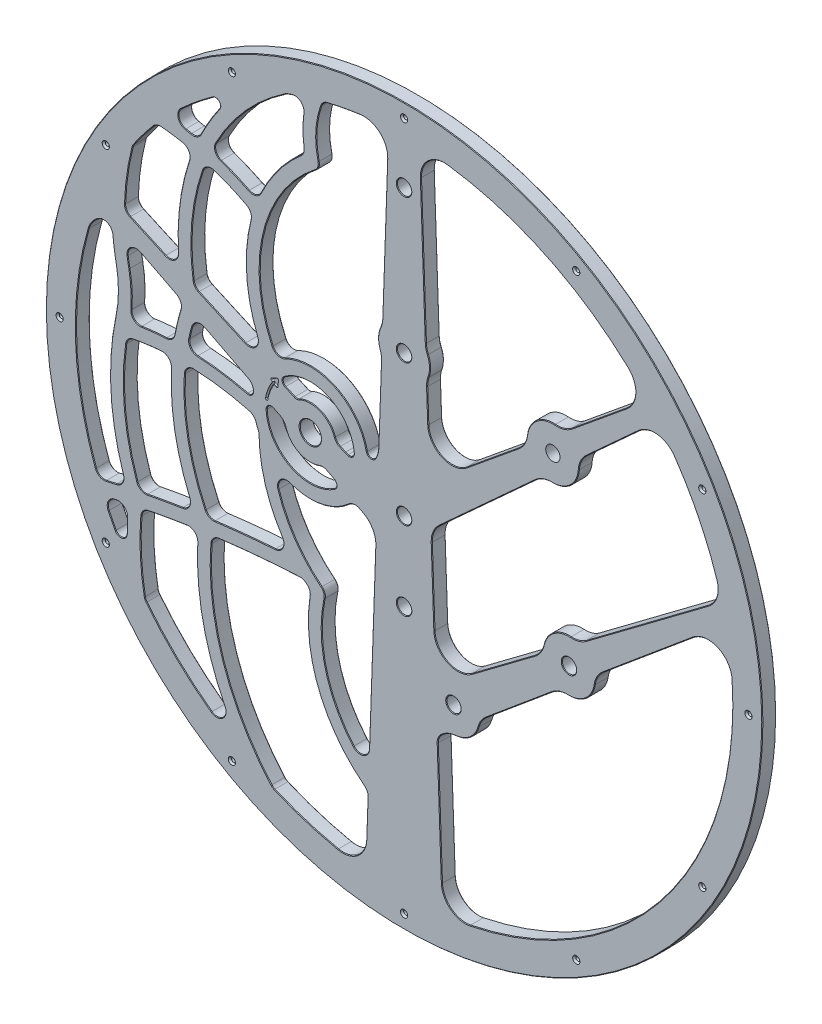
SolidWorks part; units mm, degrees
ref_plane "Спереди" through (0, 0, 0) normal (0, 0, 1) x (1, 0, 0)
ref_plane "Сверху" through (0, 0, 0) normal (0, 1, 0) x (1, 0, 0)
ref_plane "Справа" through (0, 0, 0) normal (1, 0, 0) x (0, 0, -1)
sketch "Эскиз1" plane through (0, 0, 0) normal (0, 0, 1) x (1, 0, 0)
  line L0 (0, 186.4729) -> (0, -155) construction
  line L1 (-16.3751, -129.4979) -> (-15.7977, -112.9638)
  line L2 (16.3751, -129.4979) -> (14.5719, -77.8624)
  line L3 (0, -76.9749) -> (149.4043, 41.2718) construction
  line L4 (131.591, 32.2745) -> (78.8549, -7.2633)
  line L5 (125.016, 16.8683) -> (86.0498, -15.6663)
  line L6 (131.591, 32.2745) -> (144.5236, 42.5101) construction
  line L7 (125.016, 16.8683) -> (148.2452, 35.2532) construction
  line L8 (56.5522, -23.9843) -> (29.3788, -44.357)
  line L9 (63.9818, -34.0918) -> (35.5262, -57.8507)
  line L10 (16.6684, -73.5959) -> (16.3643, -73.8498)
  line L11 (13.1304, -36.5825) -> (11.9911, -3.957)
  line L12 (7.3018, 130.3247) -> (6.2562, 160.2685) construction
  line L13 (-7.3018, 130.3247) -> (-6.2562, 160.2685) construction
  line L14 (-9.4332, 69.2905) -> (-7.3018, 130.3247)
  line L15 (9.4332, 69.2905) -> (7.3018, 130.3247)
  line L16 (0, 0) -> (117.2281, 101.403) construction
  line L17 (27.0773, 31.8104) -> (49.5494, 50.2429)
  line L18 (15.2992, 3.905) -> (56.8548, 41.7974)
  line L19 (10.4801, 39.3113) -> (9.9885, 53.3878)
  line L20 (72.6219, 69.1679) -> (96.3175, 88.604)
  line L21 (78.9053, 61.904) -> (101.5512, 82.5535)
  line L22 (96.3175, 88.604) -> (114.4037, 104.2487) construction
  line L23 (101.5512, 82.5535) -> (118.1278, 96.8925) construction
  line L24 (0, -8.6) -> (-142.8528, 60.1504) construction
  line L25 (-25.4723, 11.1102) -> (-27.7546, 12.1359)
  line L26 (-17.9626, -7.7925) -> (-19.3494, -7.0798)
  line L27 (-11.1537, 20.0228) -> (-9.9885, 53.3878)
  line L28 (-122.0022, 45.6766) -> (-146.1883, 57.3165) construction
  line L29 (-120.0439, 53.6123) -> (-142.9642, 64.6432) construction
  line L30 (0, 0) -> (74.5, 129.0378) construction
  line L31 (-47.3418, 20.9387) -> (-51.3616, 22.7453)
  line L32 (-53.4471, 10.444) -> (-56.5426, 12.0349)
  line L33 (-30.3696, -1.4162) -> (-33.465, 0.1746)
  line L34 (-67.446, 17.6385) -> (-86.2562, 27.3056)
  line L35 (-68.6353, 30.5084) -> (-88.8076, 39.5742)
  line L36 (-13.8912, -58.3698) -> (-12.4529, -17.1836)
  line L37 (-15.1654, -94.8587) -> (-13.8912, -58.3698)
  line L38 (-98.6043, 33.6517) -> (-114.0885, 41.6095)
  line L39 (-114.0885, 41.6095) -> (-122.0022, 45.6766) construction
  line L40 (0, 0) -> (-21.75, 0) construction
  line L41 (0, 0) -> (0, -515) construction
  line L42 (0, -515) -> (-21.75, -515) construction
  line L43 (-21.75, 0) -> (-21.75, -515) construction
  line L44 (0, 0) -> (-16.242, 0) construction
  line L45 (0, 0) -> (0, -10.44) construction
  line L46 (0, -10.44) -> (-16.242, -10.44) construction
  line L47 (-16.242, 0) -> (-16.242, -10.44) construction
  line L48 (0, 0) -> (-15.76, 0) construction
  line L49 (0, 0) -> (0, 53.234) construction
  line L50 (0, 53.234) -> (-15.76, 53.234) construction
  line L51 (-15.76, 0) -> (-15.76, 53.234) construction
  line L52 (-120.0439, 53.6123) -> (-118.463, 52.9019) construction
  line L53 (0, 0) -> (-96.1164, -104.5258) construction
  line L54 (-130.0207, 42.0165) -> (-122.0022, 42.0165) construction
  line L55 (-130.0207, 42.0165) -> (-130.0207, 45.6766) construction
  line L56 (-130.0207, 45.6766) -> (-122.0022, 45.6766) construction
  line L57 (-122.0022, 42.0165) -> (-122.0022, 45.6766) construction
  line L58 (-129.0378, 74.5) -> (-116.9012, 74.5) construction
  line L59 (-129.0378, 74.5) -> (-129.0378, 56.377) construction
  line L60 (-129.0378, 56.377) -> (-116.9012, 56.377) construction
  line L61 (-116.9012, 74.5) -> (-116.9012, 56.377) construction
  line L62 (-103.1694, 46.0287) -> (-118.463, 52.9019)
  line L64 (-149, 0) -> (-114.2, 0) construction
  line L65 (-149, 0) -> (-149, -5.465) construction
  line L66 (-149, -5.465) -> (-114.2, -5.465) construction
  line L67 (-114.2, 0) -> (-114.2, -5.465) construction
  arc A0 (-6.4448, 154.866) -> (0, 155) centre (0, 0) ccw
  arc A1 (135.1675, 43.5172) -> (116.7502, 80.8293) centre (0, 0) ccw
  circle A2 centre (0, 0) radius 3.1
  circle A3 centre (0, 61) radius 3.1
  circle A4 centre (0, 123.05) radius 3.1
  circle A5 centre (0, 156.05) radius 2.15 construction
  arc A6 (6.2562, 160.2685) -> (-6.2562, 160.2685) centre (0, 160.05) ccw construction
  circle A7 centre (0, 0) radius 63.75 construction
  circle A8 centre (21.37, -60.0615) radius 3.1
  circle A9 centre (71.3581, -20.4982) radius 3.1
  arc A10 (72.0949, -9.2724) -> (60.3758, -18.0585) centre (71.3581, -20.4982) ccw
  arc A11 (70.9038, -31.7391) -> (82.4995, -22.0572) centre (71.3581, -20.4982) ccw
  circle A12 centre (0, 0) radius 142 construction
  arc A13 (125.016, 16.8683) -> (141.6636, 9.7683) centre (131.5277, 9.0694) cw
  arc A14 (131.591, 32.2745) -> (135.1675, 43.5172) centre (125.4964, 40.4036) ccw
  arc A15 (22.3211, -71.2712) -> (32.23, -62.9978) centre (21.37, -60.0615) ccw
  arc A16 (13.1304, -36.5825) -> (29.3788, -44.357) centre (23.2842, -36.228) ccw
  arc A17 (22.3211, -71.2712) -> (16.6684, -73.5959) centre (23.18, -81.3949) ccw
  arc A18 (35.5262, -57.8507) -> (32.23, -62.9978) centre (42.0379, -65.6496) ccw
  arc A19 (56.5522, -23.9843) -> (60.3758, -18.0585) centre (50.4576, -15.8552) ccw
  arc A20 (63.9818, -34.0918) -> (70.9038, -31.7391) centre (70.4935, -41.8908) cw
  arc A21 (86.0498, -15.6663) -> (82.4995, -22.0572) centre (92.5615, -23.4652) ccw
  arc A22 (78.8549, -7.2633) -> (72.0949, -9.2724) centre (72.7603, 0.8658) cw
  arc A23 (14.5719, -77.8624) -> (16.3643, -73.8498) centre (19.5689, -77.6879) cw
  arc A24 (28.5733, -139.0955) -> (141.6636, 9.7683) centre (0, 0) ccw
  arc A25 (28.5733, -139.0955) -> (16.3751, -129.4979) centre (26.5289, -129.1434) cw
  arc A26 (-28.5733, -139.0955) -> (-16.3751, -129.4979) centre (-26.5289, -129.1434) ccw
  circle A27 centre (0, 0) radius 155 construction
  arc A28 (-18.8008, 140.7499) -> (-33.1506, 138.0762) centre (0, 0) ccw
  arc A29 (-10.2921, 65.5426) -> (-10.5839, 57.1864) centre (0, 61) ccw
  arc A30 (10.5839, 57.1864) -> (10.2921, 65.5426) centre (0, 61) ccw
  arc A31 (9.4332, 69.2905) -> (10.2921, 65.5426) centre (19.587, 69.645) ccw
  arc A32 (9.9885, 53.3878) -> (10.5839, 57.1864) centre (20.1424, 53.7423) cw
  arc A33 (-9.9885, 53.3878) -> (-10.5839, 57.1864) centre (-20.1424, 53.7423) ccw
  arc A34 (-9.4332, 69.2905) -> (-10.2921, 65.5426) centre (-19.587, 69.645) cw
  circle A35 centre (64.38, 55.6891) radius 3.1
  arc A36 (64.023, 44.4447) -> (75.6095, 55.0099) centre (64.38, 55.6891) ccw
  arc A37 (65.325, 66.8993) -> (53.2015, 56.9551) centre (64.38, 55.6891) ccw
  arc A38 (96.8001, 103.893) -> (18.8008, 140.7499) centre (0, 0) ccw
  arc A39 (116.7502, 80.8293) -> (101.5512, 82.5535) centre (108.3968, 75.046) ccw
  arc A40 (96.3175, 88.604) -> (96.8001, 103.893) centre (89.8741, 96.4595) ccw
  arc A41 (27.0773, 31.8104) -> (10.4801, 39.3113) centre (20.6339, 39.6659) cw
  arc A42 (15.2992, 3.905) -> (11.9911, -3.957) centre (22.1449, -3.6025) ccw
  arc A43 (49.5494, 50.2429) -> (53.2015, 56.9551) centre (43.106, 58.0984) ccw
  arc A44 (64.023, 44.4447) -> (56.8548, 41.7974) centre (63.7005, 34.2899) ccw
  arc A45 (78.9053, 61.904) -> (75.6095, 55.0099) centre (85.7509, 54.3965) ccw
  arc A46 (72.6219, 69.1679) -> (65.325, 66.8993) centre (66.1785, 77.0234) cw
  arc A47 (7.3018, 130.3247) -> (18.8008, 140.7499) centre (17.4557, 130.6793) cw
  arc A48 (-18.8008, 140.7499) -> (-7.3018, 130.3247) centre (-17.4557, 130.6793) cw
  circle A49 centre (0, 0) radius 149 construction
  arc A50 (0, 155) -> (-6.4448, 154.866) centre (0, 0) ccw
  arc A51 (-136.4071, 39.46) -> (-133.3452, -48.8166) centre (0, 0) ccw
  arc A52 (-67.7573, 12.0751) -> (-89.3834, 15.2852) centre (-96.1164, -104.5258) ccw
  arc A53 (-124.8807, 12.3334) -> (-124.731, 32.1079) centre (-173.8171, 22.5916) ccw
  arc A54 (-17.9626, -7.7925) -> (-12.4529, -17.1836) centre (-22.6068, -16.829) cw
  arc A55 (-11.1537, 20.0228) -> (-12.3895, 15.5095) centre (-21.3075, 20.3773) cw
  circle A56 centre (0, 149) radius 0.8625
  circle A57 centre (74.5, 129.0378) radius 0.8625
  circle A58 centre (129.0378, 74.5) radius 0.8625
  circle A59 centre (149, 0) radius 0.8625
  circle A60 centre (129.0378, -74.5) radius 0.8625
  circle A61 centre (74.5, -129.0378) radius 0.8625
  circle A62 centre (0, -149) radius 0.8625
  circle A63 centre (-74.5, -129.0378) radius 0.8625
  circle A64 centre (-129.0378, -74.5) radius 0.8625
  circle A65 centre (-149, 0) radius 0.8625
  circle A66 centre (-129.0378, 74.5) radius 0.8625
  circle A67 centre (-74.5, 129.0378) radius 0.8625
  circle A68 centre (0, -34) radius 3.1
  circle A69 centre (-40.57, 10.925) radius 4.6
  arc A70 (-51.4183, 7.9457) -> (-36.6774, 0.3699) centre (-40.57, 10.925) ccw
  arc A71 (-59.4552, 10.1769) -> (-30.1848, -4.8661) centre (-40.57, 10.925) ccw
  arc A72 (-65.403, 13.8101) -> (-65.414, 13.7136) centre (-40.57, 10.925) ccw
  arc A73 (-29.9064, 14.5098) -> (-45.6235, 20.9761) centre (-40.57, 10.925) ccw
  arc A74 (-21.7622, 12.7895) -> (-51.7219, 26.1843) centre (-40.57, 10.925) ccw
  arc A75 (-24.3517, 10.6841) -> (-25.4723, 11.1102) centre (-21.3075, 20.3773) cw
  arc A76 (-16.1024, 16.0572) -> (-51.7262, 33.2977) centre (-40.57, 10.925) ccw
  arc A77 (-47.3418, 20.9387) -> (-45.6235, 20.9761) centre (-46.5219, 22.763) ccw
  arc A78 (-27.7546, 12.1359) -> (-29.9064, 14.5098) centre (-26.1149, 15.7844) cw
  arc A79 (-53.4471, 10.444) -> (-51.4183, 7.9457) centre (-55.2755, 6.8864) cw
  arc A80 (-33.465, 0.1746) -> (-36.6774, 0.3699) centre (-35.2934, -3.383) ccw
  arc A81 (-51.7219, 26.1843) -> (-51.3616, 22.7453) centre (-50.5418, 24.5696) ccw
  arc A82 (-59.4552, 10.1769) -> (-56.5426, 12.0349) centre (-57.4568, 10.256) cw
  arc A83 (-30.1848, -4.8661) -> (-30.3696, -1.4162) centre (-31.2838, -3.195) ccw
  arc A84 (-21.7622, 12.7895) -> (-24.3517, 10.6841) centre (-23.7524, 12.5922) cw
  arc A85 (-12.3895, 15.5095) -> (-16.1024, 16.0572) centre (-14.145, 16.4677) cw
  arc A86 (-19.3494, -7.0798) -> (-23.8526, -7.6633) centre (-21.1778, -10.6375) ccw
  circle A87 centre (0, 0) radius 60 construction
  arc A88 (-62.9931, -0.9293) -> (-52.8193, -34.3383) centre (0, 0) ccw
  arc A89 (-54.3464, -17.1891) -> (-35.7177, -44.4212) centre (0, 0) ccw
  circle A90 centre (0, 0) radius 63 construction
  circle A91 centre (0, 0) radius 57 construction
  arc A92 (-49.3723, -12.4741) -> (-23.8526, -7.6633) centre (-40.57, 10.925) ccw
  circle A93 centre (21.37, -60.0615) radius 60 construction
  arc A94 (-40.8697, -50.3034) -> (-17.2686, -109.8215) centre (21.37, -60.0615) ccw
  arc A95 (-34.3788, -48.1843) -> (-21.8629, -97.2088) centre (21.37, -60.0615) ccw
  circle A96 centre (21.37, -60.0615) radius 63 construction
  circle A97 centre (21.37, -60.0615) radius 57 construction
  circle A98 centre (0, 61) radius 65.5 construction
  arc A99 (-44.7583, 112.8551) -> (-61.9756, 90.1767) centre (0, 61) ccw
  arc A100 (-38.337, 110.3611) -> (-56.8947, 35.1303) centre (0, 61) ccw
  circle A101 centre (0, 61) radius 68.5 construction
  circle A102 centre (0, 61) radius 62.5 construction
  circle A103 centre (0, 123.05) radius 41 construction
  arc A104 (-56.8947, 35.1303) -> (-51.7262, 33.2977) centre (-53.4264, 36.7073) ccw
  arc A105 (-43.5549, 129.2928) -> (-43.4825, 116.3219) centre (0, 123.05) ccw
  arc A106 (-35.8562, 135.6331) -> (-36.9676, 114.2523) centre (0, 123.05) ccw
  circle A107 centre (0, 123.05) radius 44 construction
  circle A108 centre (0, 123.05) radius 38 construction
  arc A109 (-48.6312, 133.4129) -> (-50.4697, 132.7283) centre (0, 0) ccw
  circle A110 centre (21.37, -60.0615) radius 108 construction
  arc A111 (-89.4917, -54.523) -> (-77.6629, -110.1961) centre (21.37, -60.0615) ccw
  arc A112 (-83.329, -52.1162) -> (-57.3991, -129.4908) centre (21.37, -60.0615) ccw
  circle A113 centre (21.37, -60.0615) radius 111 construction
  circle A114 centre (21.37, -60.0615) radius 105 construction
  arc A115 (-56.0447, -130.4722) -> (-28.5733, -139.0955) centre (0, 0) ccw
  circle A116 centre (0, 0) radius 98 construction
  arc A117 (-96.6981, 29.1629) -> (-99.3106, 18.3956) centre (0, 0) ccw
  arc A118 (-91.6743, 24.9162) -> (-92.8952, 19.8867) centre (0, 0) ccw
  circle A119 centre (0, 0) radius 95 construction
  circle A120 centre (0, 0) radius 101 construction
  circle A121 centre (-21.75, -515) radius 473 construction
  arc A122 (-55.7416, -40.2152) -> (-81.9288, -42.8194) centre (-21.75, -515) ccw
  arc A123 (-45.1814, -45.5844) -> (-80.0021, -48.6239) centre (-21.75, -515) ccw
  circle A124 centre (-21.75, -515) radius 476 construction
  circle A125 centre (-21.75, -515) radius 470 construction
  arc A126 (-42.4257, -46.5731) -> (-42.0884, -46.8782) centre (0, 0) ccw
  arc A127 (-93.8817, -50.5681) -> (-110.5586, -53.4667) centre (-21.75, -515) ccw
  arc A128 (-95.8482, -44.8027) -> (-111.0888, -47.459) centre (-21.75, -515) ccw
  arc A129 (-127.7958, -61.9051) -> (-124.7704, -67.7963) centre (0, 0) ccw
  circle A130 centre (0, -66) radius 117 construction
  arc A131 (-119.8631, -60.2691) -> (-119.9986, -66.5715) centre (0, -66) ccw
  arc A132 (-113.6365, -56.904) -> (-112.1658, -86.3674) centre (0, -66) ccw
  circle A133 centre (0, -66) radius 114 construction
  circle A134 centre (0, -66) radius 120 construction
  arc A135 (-124.5017, -56.3693) -> (-125.2055, -56.5276) centre (-21.75, -515) ccw
  arc A136 (-111.4063, -88.0491) -> (-83.2971, -115.0026) centre (0, 0) ccw
  arc A137 (-119.8631, -60.2691) -> (-124.5017, -56.3693) centre (-123.6687, -60.0872) ccw
  arc A138 (-127.7958, -61.9051) -> (-125.2055, -56.5276) centre (-124.3669, -60.2441) cw
  arc A139 (-43.5549, 129.2928) -> (-48.6312, 133.4129) centre (-47.3263, 129.8333) ccw
  arc A140 (-35.8562, 135.6331) -> (-33.1506, 138.0762) centre (-32.2611, 134.3715) cw
  arc A141 (-43.4825, 116.3219) -> (-44.7583, 112.8551) centre (-47.2477, 115.7393) cw
  arc A142 (-36.9676, 114.2523) -> (-38.337, 110.3611) centre (-40.674, 113.3702) cw
  arc A143 (-62.9931, -0.9293) -> (-63.3336, 0.5896) centre (-66.8027, -0.9855) ccw
  arc A144 (-55.7416, -40.2152) -> (-52.8193, -34.3383) centre (-56.0136, -36.415) ccw
  arc A145 (-85.8537, -40.6711) -> (-81.9288, -42.8194) centre (-82.4105, -39.04) ccw
  arc A146 (-113.6365, -56.904) -> (-110.5586, -53.4667) centre (-109.8387, -57.208) cw
  arc A147 (-112.1658, -86.3674) -> (-111.4063, -88.0491) centre (-108.4171, -85.6867) ccw
  arc A148 (-89.4917, -54.523) -> (-93.8817, -50.5681) centre (-93.297, -54.3329) ccw
  arc A149 (-77.6629, -110.1961) -> (-83.2971, -115.0026) centre (-81.0622, -111.9169) cw
  arc A150 (-57.3991, -129.4908) -> (-56.0447, -130.4722) centre (-54.5409, -126.9715) ccw
  arc A151 (-17.2686, -109.8215) -> (-15.7977, -112.9638) centre (-19.6053, -112.8308) cw
  arc A152 (-45.1814, -45.5844) -> (-42.4257, -46.5731) centre (-44.9915, -49.3897) cw
  arc A153 (-42.0884, -46.8782) -> (-40.8697, -50.3034) centre (-44.6337, -49.7133) cw
  arc A154 (-54.3464, -17.1891) -> (-49.3723, -12.4741) centre (-50.7138, -16.0401) cw
  arc A155 (-34.3788, -48.1843) -> (-35.7177, -44.4212) centre (-38.1052, -47.3904) ccw
  arc A156 (-21.8629, -97.2088) -> (-15.1654, -94.8587) centre (-18.9731, -94.7258) ccw
  arc A157 (-83.329, -52.1162) -> (-80.0021, -48.6239) centre (-79.5299, -52.4045) cw
  arc A158 (-119.9986, -66.5715) -> (-124.7704, -67.7963) centre (-122.5386, -66.5836) cw
  circle A159 centre (-16.242, -10.44) radius 108 construction
  arc A160 (-124.8807, 12.3334) -> (-121.6296, -45.2891) centre (-16.242, -10.44) ccw
  arc A161 (-120.2007, 4.3112) -> (-115.402, -44.9697) centre (-16.242, -10.44) ccw
  circle A162 centre (-16.242, -10.44) radius 105 construction
  circle A163 centre (-16.242, -10.44) radius 111 construction
  arc A164 (-124.4251, -50.2056) -> (-128.9097, -51.219) centre (-21.75, -515) ccw
  circle A165 centre (-15.76, 53.234) radius 108 construction
  arc A166 (-126.2289, 42.3888) -> (-124.731, 32.1079) centre (-15.76, 53.234) ccw
  arc A167 (-117.4443, 79.4125) -> (-120.7093, 56.4954) centre (-15.76, 53.234) ccw
  circle A168 centre (-15.76, 53.234) radius 111 construction
  circle A169 centre (-15.76, 53.234) radius 105 construction
  arc A170 (-119.5979, 37.6555) -> (-118.8407, 33.2499) centre (-15.76, 53.234) ccw
  arc A171 (-132.0447, 45.2445) -> (-136.4071, 39.46) centre (-126.6473, 36.6367) ccw
  arc A172 (-117.9854, 18.2535) -> (-118.8407, 33.2499) centre (-173.8171, 22.5916) ccw
  circle A173 centre (-173.8171, 22.5916) radius 50 construction
  circle A174 centre (-173.8171, 22.5916) radius 56 construction
  arc A175 (-117.4443, 79.4125) -> (-116.8909, 80.6258) centre (-113.7546, 78.4626) cw
  arc A176 (-126.2289, 42.3888) -> (-132.0447, 45.2445) centre (-130.0207, 42.0165) ccw
  arc A177 (-119.5979, 37.6555) -> (-114.0885, 41.6095) centre (-115.8301, 38.2208) cw
  arc A178 (-96.6981, 29.1629) -> (-98.6043, 33.6517) centre (-100.3458, 30.263) ccw
  arc A179 (-67.446, 17.6385) -> (-65.403, 13.8101) centre (-69.1875, 14.2498) cw
  arc A180 (-91.6743, 24.9162) -> (-86.2562, 27.3056) centre (-87.9977, 23.9169) cw
  arc A181 (-92.9355, -39.5474) -> (-95.8482, -44.8027) centre (-96.4413, -41.0392) cw
  arc A182 (-115.402, -44.9697) -> (-111.0888, -47.459) centre (-111.8039, -43.7167) ccw
  arc A183 (-133.3452, -48.8166) -> (-128.9097, -51.219) centre (-129.7674, -47.5068) ccw
  arc A184 (-121.6296, -45.2891) -> (-124.4251, -50.2056) centre (-125.2469, -46.4853) cw
  arc A185 (-120.7093, 56.4954) -> (-118.463, 52.9019) centre (-116.9012, 56.377) ccw
  arc A186 (-66.9918, 5.6911) -> (-90.845, 9.3523) centre (-96.1164, -104.5258) ccw
  circle A187 centre (-96.1164, -104.5258) radius 114 construction
  circle A188 centre (-96.1164, -104.5258) radius 120 construction
  arc A189 (-100.8692, 5.1376) -> (-92.9355, -39.5474) centre (0, 0) ccw
  arc A190 (-102.8433, 15.2855) -> (-113.6307, 14.1892) centre (-96.1164, -104.5258) ccw
  arc A191 (-104.9702, 9.1299) -> (-117.1308, 7.5206) centre (-96.1164, -104.5258) ccw
  arc A192 (-94.8241, 5.7781) -> (-85.8537, -40.6711) centre (0, 0) ccw
  arc A193 (-64.3423, 3.1868) -> (-63.3336, 0.5896) centre (-40.57, 10.925) ccw
  arc A194 (-66.9918, 5.6911) -> (-64.3423, 3.1868) centre (-67.9651, 2.0075) cw
  arc A195 (-89.3834, 15.2852) -> (-92.8952, 19.8867) centre (-89.1696, 19.0892) cw
  arc A196 (-90.845, 9.3523) -> (-94.8241, 5.7781) centre (-91.0212, 5.5463) ccw
  arc A197 (-100.8692, 5.1376) -> (-104.9702, 9.1299) centre (-104.6743, 5.3314) ccw
  arc A198 (-99.3106, 18.3956) -> (-102.8433, 15.2855) centre (-103.0569, 19.0895) cw
  arc A199 (-67.7573, 12.0751) -> (-65.414, 13.7136) centre (-67.3071, 13.9261) ccw
  arc A200 (-113.6307, 14.1892) -> (-117.9854, 18.2535) centre (-114.1868, 17.9584) cw
  arc A201 (-117.1308, 7.5206) -> (-120.2007, 4.3112) centre (-116.4284, 3.7759) ccw
  circle A202 centre (0, 55.92) radius 95 construction
  arc A203 (-79.9182, 112.6394) -> (-87.9103, 99.2302) centre (0, 55.92) ccw
  arc A204 (-51.2375, 132.3315) -> (-81.335, 98.9156) centre (0, 55.92) ccw
  circle A205 centre (0, 55.92) radius 98 construction
  circle A206 centre (0, 55.92) radius 92 construction
  arc A207 (-82.7141, 115.4226) -> (-96.4448, 104.2229) centre (0, 0) ccw
  arc A208 (-51.2375, 132.3315) -> (-50.4697, 132.7283) centre (-49.1156, 129.1671) cw
  arc A209 (-91.015, 42.4933) -> (-88.8076, 39.5742) centre (-87.2458, 43.0494) ccw
  arc A210 (-97.8052, 49.744) -> (-103.1694, 46.0287) centre (-101.6076, 49.5038) cw
  arc A211 (-67.1306, 88.3938) -> (-79.2354, 93.5424) centre (-114.2, -5.465) ccw
  arc A212 (-68.2992, 82.2511) -> (-82.1623, 88.2078) centre (-114.2, -5.465) ccw
  circle A213 centre (-114.2, -5.465) radius 99 construction
  circle A214 centre (-114.2, -5.465) radius 105 construction
  arc A215 (-108.3499, 91.784) -> (-116.8909, 80.6258) centre (0, 0) ccw
  arc A216 (-66.374, 77.9335) -> (-63.5394, 35.4071) centre (0, 61) ccw
  arc A217 (-95.8915, 91.8273) -> (-105.0923, 93.1152) centre (-114.2, -5.465) ccw
  arc A218 (-92.1289, 97.1891) -> (-94.5694, 97.6836) centre (-114.2, -5.465) ccw
  arc A219 (-86.9981, 85.8419) -> (-91.015, 42.4933) centre (0, 55.92) ccw
  arc A220 (-92.9813, 86.8794) -> (-97.8052, 49.744) centre (0, 55.92) ccw
  arc A221 (-94.5694, 97.6836) -> (-96.4448, 104.2229) centre (-93.8571, 101.4264) cw
  arc A222 (-92.1289, 97.1891) -> (-87.9103, 99.2302) centre (-91.3281, 100.914) ccw
  arc A223 (-79.2354, 93.5424) -> (-81.335, 98.9156) centre (-77.9667, 97.135) cw
  arc A224 (-67.1306, 88.3938) -> (-61.9756, 90.1767) centre (-65.4227, 91.7995) ccw
  arc A225 (-68.2992, 82.2511) -> (-66.374, 77.9335) centre (-70.0657, 78.8754) cw
  arc A226 (-82.1623, 88.2078) -> (-86.9981, 85.8419) centre (-83.3953, 84.6028) ccw
  arc A227 (-95.8915, 91.8273) -> (-92.9813, 86.8794) centre (-96.5961, 88.0831) cw
  arc A228 (-105.0923, 93.1152) -> (-108.3499, 91.784) centre (-105.4428, 89.3213) ccw
  arc A229 (-79.9182, 112.6394) -> (-82.7141, 115.4226) centre (-81.5491, 113.7969) ccw
  arc A230 (-68.6353, 30.5084) -> (-63.5394, 35.4071) centre (-67.0735, 33.9836) ccw
  point P47 (19.5766, -71.1677)
  point P53 (67.5738, -31.0927)
  point P76 (9.9087, 55.6728)
  point P96 (104.9334, 95.6712)
  point P101 (11.1969, 18.7847)
  point P112 (68.8011, 66.034)
  point P119 (6.4448, 154.866)
  point P122 (-6.4448, 154.866)
  point P133 (-132.4982, 51.0708)
  point P181 (-29.4982, 12.9195)
  point P192 (-27.6119, -2.8335)
  point P195 (-21.683, 10.2243)
  point P198 (-15.5922, 11.9773)
  point P276 (-119.5204, -55.2817)
  point P279 (-129.7983, -57.5882)
  point P282 (-42.1745, 135.5925)
  point P299 (-111.9919, -87.303)
  point P302 (-89.1602, -49.8593)
  point P307 (-56.8287, -130.1326)
  point P312 (-43.5677, -45.5067)
  point P317 (-56.3703, -8.4489)
  point P322 (-15.4692, -103.5572)
  point P364 (-95.737, 32.1781)
  point P371 (-90.8888, -44.048)
  point P378 (-120.2188, -49.2964)
  point P397 (-64.885, 5.1127)
  point P402 (-94.5275, 9.4631)
  point P405 (-100.5628, 9.3875)
  point P408 (-99.8164, 15.4172)
  point P431 (-97.1894, 43.3411)
  point P456 (-65.5834, 80.7755)
  point P459 (-85.7122, 89.3477)
  point P462 (-91.5418, 90.9072)
  point P465 (-107.0667, 93.2777)
  point P468 (-72.0208, 122.3806)
  dimension "D1" = 310
  dimension "D2" = 13
  dimension "D3" = 6.2
  dimension "D6" = 4.3
  dimension "D8" = 12.52
  dimension "D12" = 127.5
  dimension "D15" = 22.5
  dimension "D17" = 10.16
  dimension "D22" = 10.16
  dimension "D23" = 10.16
  dimension "D24" = 5
  dimension "D26" = 10.16
  dimension "D28" = 10.16
  dimension "D32" = 10.16
  dimension "D36" = 10.16
  dimension "D37" = 10.16
  dimension "D38" = 10.16
  dimension "D39" = 298
  dimension "D44" = 3.66
  dimension "D47" = 10.16
  dimension "D48" = 1.725
  dimension "D52" = 9.2
  dimension "D54" = 37.8
  dimension "D55" = 50
  dimension "D56" = 2
  dimension "D57" = 4
  dimension "D58" = 4
  dimension "D59" = 2
  dimension "D60" = 2
  dimension "D61" = 4
  dimension "D62" = 120
  dimension "D67" = 131
  dimension "D70" = 82
  dimension "D73" = 216
  dimension "D76" = 196
  dimension "D81" = 946
  dimension "D84" = 234
  dimension "D88" = 3.81
  dimension "D89" = 2.54
  dimension "D92" = 216
  dimension "D97" = 216
  dimension "D100" = 10.16
  dimension "D101" = 100
  dimension "D103" = 3.81
  dimension "D104" = 7.62
  dimension "D107" = 240
  dimension "D109" = 3.81
  dimension "D110" = 1.905
  dimension "D111" = 3.81
  dimension "D112" = 190
  dimension "D116" = 3.81
  dimension "D119" = 210
  dimension "D121" = 3.81
  dimension "D122" = 2
  dimension "D123" = 7.62
  dimension "D124" = 3.81
  dimension "D4" = 61
  dimension "D5" = 62.05
  dimension "D7" = 156.05
  dimension "D9" = 4
  dimension "D10" = 4
  dimension "D11" = 51.64
  dimension "D13" = 21.37
  dimension "D14" = 63.75
  dimension "D16" = 3
  dimension "D18" = 8
  dimension "D19" = 4
  dimension "D20" = 1.5
  dimension "D21" = 2
  dimension "D25" = 2
  dimension "D27" = 32.7501
  dimension "D29" = 64.38
  dimension "D30" = 49.14
  dimension "D31" = 3
  dimension "D33" = 1.5
  dimension "D34" = 8
  dimension "D35" = 4
  dimension "D40" = 64.3
  dimension "D41" = 8.6
  dimension "D42" = 1.5
  dimension "D43" = 3
  dimension "D45" = 4
  dimension "D46" = 8
  dimension "D50" = 30
  dimension "D51" = 34
  dimension "D53" = 40.57
  dimension "D79" = 21.75
  dimension "D80" = 515
  dimension "D85" = 32
  dimension "D90" = 16.242
  dimension "D91" = 10.44
  dimension "D95" = 15.76
  dimension "D96" = 53.234
  dimension "D102" = 6
  dimension "D105" = 18.123
  dimension "D106" = 42.6
  dimension "D113" = 5.08
  dimension "D117" = 34.8
  dimension "D118" = 5.465
  dimension "D63" = 3
  dimension "D64" = 3
  dimension "D65" = 3
  dimension "D66" = 3
  dimension "D68" = 3
  dimension "D69" = 3
  dimension "D71" = 3
  dimension "D72" = 3
  dimension "D74" = 3
  dimension "D75" = 3
  dimension "D77" = 3
  dimension "D78" = 3
  dimension "D82" = 3
  dimension "D83" = 3
  dimension "D86" = 3
  dimension "D87" = 3
  dimension "D93" = 3
  dimension "D94" = 3
  dimension "D98" = 3
  dimension "D99" = 3
  dimension "D108" = 6
  dimension "D114" = 3
  dimension "D115" = 3
  dimension "D120" = 6
  dimension "D49" = 12
extrude "Бобышка-Вытянуть1" add sketch "Эскиз1" along normal blind 6
chamfer "Фаска1" distance 0.7 angle 45 12 edges at (-73.6375, 129.0378, 6) (-128.1753, 74.5, 6) (-148.1375, 0, 6) (-128.1753, -74.5, 6) (-73.6375, -129.0378, 6) (0.8625, -149, 6) (75.3625, -129.0378, 6) (129.9003, -74.5, 6) (149.8625, 0, 6) (129.9003, 74.5, 6) (75.3625, 129.0378, 6) (0.8625, 149, 6)
chamfer "Фаска2" distance 0.25 angle 45 211 edges at (-89.7543, 110.0371, 0) (-80.1382, 115.2144, 0) (-84.1817, 106.0942, 0) (-89.6687, 97.4843, 0) (-93.3477, 97.4436, 0) (-97.5194, 100.3761, 0) (-65.4085, 13.7619, 0) (-66.2154, 12.3649, 0) (-78.4971, 14.1737, 0) (-92.1983, 16.7777, 0) (-92.319, 22.4098, 0) (-89.5351, 27.403, 0) (-76.8511, 22.472, 0) (-65.8262, 16.0436, 0) (-112.7585, 86.3106, 0) (-106.884, 92.8482, 0) (-100.4768, 92.5792, 0) (-93.3121, 90.0147, 0) (-97.1835, 68.5443, 0) (-99.4383, 46.3717, 0) (-110.8162, 49.4653, 0) (-120.1319, 54.3575, 0) (-119.7103, 68.0442, 0) (-117.2211, 80.0436, 0) (-60.2675, -18.3529, 0) (-52.6021, -38.1113, 0) (-68.8532, -41.3363, 0) (-84.2399, -42.3821, 0) (-93.2765, -18.0138, 0) (-93.5672, 8.3808, 0) (-78.8212, 8.1546, 0) (-65.348, 4.7764, 0) (-63.8741, 1.8742, 0) (-63.085, -0.1522, 0) (-119.9722, -63.4194, 0) (-121.9071, -69.0439, 0) (-126.3174, -64.8684, 0) (-127.7994, -58.5908, 0) (-124.8536, -56.4483, 0) (-121.2169, -57.1709, 0) (-54.9948, 11.2395, 0) (-52.1704, 9.4079, 0) (-45.7124, 0.9191, 0) (-35.0507, 0.6096, 0) (-31.9173, -0.6208, 0) (-29.2866, -3.0881, 0) (-49.2092, -5.8849, 0) (-58.5324, 11.9422, 0) (-73.6375, 129.0378, 0) (-148.1375, 0, 0) (-73.6375, -129.0378, 0) (75.3625, -129.0378, 0) (149.8625, 0, 0) (75.3625, 129.0378, 0) (-26.6135, 11.6231, 0) (-29.0786, 13.098, 0) (-36.2896, 21.3289, 0) (-46.4784, 20.7634, 0) (-49.3517, 21.842, 0) (-52.5309, 24.3612, 0) (-32.8558, 28.1791, 0) (-22.4907, 11.0404, 0) (-24.9183, 10.8806, 0) (-128.3414, 45.4365, 0) (-125.6003, 37.2308, 0) (-123.8185, 22.2132, 0) (-127.0657, -16.6929, 0) (-121.9349, -48.3685, 0) (-126.6686, -50.7069, 0) (-131.5819, -50.857, 0) (-141.9147, -4.9224, 0) (-134.759, 42.7543, 0) (67.48, 55.6891, 0) (8.3675, 99.8076, 0) (10.6315, 138.2064, 0) (60.6671, 128.3881, 0) (100.029, 96.1389, 0) (84.4697, 78.886, 0) (69.1949, 67.3215, 0) (57.2454, 64.3873, 0) (52.0305, 53.2426, 0) (38.3133, 41.0267, 0) (16.4497, 30.4075, 0) (10.2343, 46.3495, 0) (10.1049, 55.3155, 0) (11.2431, 61.3926, 0) (9.6837, 67.3755, 0) (12.5607, -20.2698, 0) (12.7801, 0.338, 0) (36.077, 22.8512, 0) (60.1805, 43.8206, 0) (71.9601, 47.3762, 0) (76.5845, 58.7786, 0) (90.2282, 72.2287, 0) (109.5421, 85.1413, 0) (127.333, 62.8515, 0) (135.1783, 37.3236, 0) (105.2229, 12.5056, 0) (75.6548, -8.8732, 0) (64.6096, -11.4971, 0) (58.9946, -21.3638, 0) (42.9655, -34.1706, 0) (18.899, -45.3929, 0) (24.47, -60.0615, 0) (3.1, 61, 0) (113.0719, -85.8996, 0) (20.2464, -137.1281, 0) (15.4735, -103.6801, 0) (15.0036, -75.6486, 0) (16.5163, -73.7229, 0) (19.3158, -71.9984, 0) (28.5803, -68.6972, 0) (33.4819, -60.1705, 0) (49.754, -45.9712, 0) (67.2238, -32.2713, 0) (78.5684, -29.1339, 0) (83.6799, -18.5313, 0) (105.5329, 0.601, 0) (135.5135, 18.4149, 0) (155, 0, 0) (3.1, 0, 0) (3.1, 123.05, 0) (74.4581, -20.4982, 0) (-56.7764, -130.0567, 0) (-78.1882, -93.4255, 0) (-82.2885, -49.7766, 0) (-62.62, -46.7803, 0) (-43.7048, -45.8035, 0) (-42.2573, -46.726, 0) (-41.0442, -48.4361, 0) (-37.1937, -83.2841, 0) (-16.1547, -111.2155, 0) (-16.0864, -121.2308, 0) (-20.2464, -137.1281, 0) (-42.5281, -135.482, 0) (-10.5711, 36.7053, 0) (-11.5082, 17.694, 0) (-14.4369, 14.4891, 0) (-29.6793, 33.4282, 0) (-60.6811, 75.9686, 0) (-37.0801, 112.1054, 0) (-37.9488, 125.0226, 0) (-34.8145, 137.1992, 0) (-26.0101, 139.5975, 0) (-10.6315, 138.2064, 0) (-8.3675, 99.8076, 0) (-9.6837, 67.3755, 0) (-11.2431, 61.3926, 0) (-10.1049, 55.3155, 0) (0.8625, 149, 0) (-13.8092, -56.0211, 0) (-17.7116, -98.3209, 0) (-33.8586, -74.1614, 0) (-34.5156, -46.1132, 0) (-47.0456, -32.1825, 0) (-53.3349, -13.275, 0) (-35.9388, -13.6423, 0) (-21.6918, -6.6706, 0) (-18.656, -7.4362, 0) (-13.8436, -11.6877, 0) (3.1, -34, 0) (129.9003, 74.5, 0) (129.9003, -74.5, 0) (0.8625, -149, 0) (-128.1753, -74.5, 0) (-128.1753, 74.5, 0) (-35.97, 10.925, 0) (-78.7214, 35.0413, 0) (-90.2847, 40.7514, 0) (-91.6075, 64.4087, 0) (-85.0696, 88.0252, 0) (-75.1171, 85.4939, 0) (-66.586, 80.427, 0) (-68.3483, 56.4442, 0) (-64.4331, 31.2369, 0) (-43.9993, 122.8046, 0) (-43.6721, 114.4235, 0) (-54.5583, 102.4204, 0) (-64.1773, 88.1988, 0) (-73.1023, 91.1579, 0) (-81.5153, 95.7483, 0) (-68.3595, 117.4909, 0) (-50.8649, 132.5518, 0) (-49.5516, 133.0738, 0) (-44.9253, 132.7916, 0) (-102.2332, -51.9423, 0) (-90.7468, -51.5023, 0) (-87.2063, -83.1306, 0) (-78.5894, -114.8155, 0) (-98.2801, -102.494, 0) (-111.8894, -87.2549, 0) (-113.8582, -71.6835, 0) (-112.6771, -54.6664, 0) (-119.2428, 35.4487, 0) (-118.0515, 41.3162, 0) (-106.3464, 37.6306, 0) (-96.8389, 31.7522, 0) (-98.1521, 23.8151, 0) (-100.5393, 16.2298, 0) (-108.2494, 14.8593, 0) (-116.7865, 15.1731, 0) (-117.908, 25.7805, 0) (-93.1089, -42.8861, 0) (-103.4793, -46.069, 0) (-113.7084, -47.0166, 0) (-120.7477, -20.6161, 0) (-119.1817, 6.4095, 0) (-111.0722, 8.4889, 0) (-102.0167, 8.0614, 0) (-99.4447, -17.6563, 0) (-54.6997, 33.1164, 0)
chamfer "Фаска3" distance 0.25 angle 45 198 edges at (155, 0, 6) (-84.1817, 106.0942, 6) (-80.1382, 115.2144, 6) (-89.6687, 97.4843, 6) (-89.7543, 110.0371, 6) (-93.3477, 97.4436, 6) (-97.5194, 100.3761, 6) (-44.9253, 132.7916, 6) (-49.5516, 133.0738, 6) (-43.9993, 122.8046, 6) (-50.8649, 132.5518, 6) (-43.6721, 114.4235, 6) (-68.3595, 117.4909, 6) (-54.5583, 102.4204, 6) (-81.5153, 95.7483, 6) (-64.1773, 88.1988, 6) (-73.1023, 91.1579, 6) (-68.3483, 56.4442, 6) (-66.586, 80.427, 6) (-75.1171, 85.4939, 6) (-85.0696, 88.0252, 6) (-91.6075, 64.4087, 6) (-90.2847, 40.7514, 6) (-78.7214, 35.0413, 6) (-106.884, 92.8482, 6) (-112.7585, 86.3106, 6) (-100.4768, 92.5792, 6) (-117.2211, 80.0436, 6) (-93.3121, 90.0147, 6) (-119.7103, 68.0442, 6) (-97.1835, 68.5443, 6) (-120.1319, 54.3575, 6) (-99.4383, 46.3717, 6) (-110.8162, 49.4653, 6) (-76.8511, 22.472, 6) (-89.5351, 27.403, 6) (-65.8262, 16.0436, 6) (-92.319, 22.4098, 6) (-65.4085, 13.7619, 6) (-92.1983, 16.7777, 6) (-66.2154, 12.3649, 6) (-78.4971, 14.1737, 6) (-118.0515, 41.3162, 6) (-106.3464, 37.6306, 6) (-119.2428, 35.4487, 6) (-96.8389, 31.7522, 6) (-117.908, 25.7805, 6) (-98.1521, 23.8151, 6) (-116.7865, 15.1731, 6) (-100.5393, 16.2298, 6) (-108.2494, 14.8593, 6) (-125.6003, 37.2308, 6) (-123.8185, 22.2132, 6) (-128.3414, 45.4365, 6) (-127.0657, -16.6929, 6) (-134.759, 42.7543, 6) (-121.9349, -48.3685, 6) (-141.9147, -4.9224, 6) (-126.6686, -50.7069, 6) (-131.5819, -50.857, 6) (-111.0722, 8.4889, 6) (-119.1817, 6.4095, 6) (-102.0167, 8.0614, 6) (-120.7477, -20.6161, 6) (-99.4447, -17.6563, 6) (-113.7084, -47.0166, 6) (-93.1089, -42.8861, 6) (-103.4793, -46.069, 6) (-124.8536, -56.4483, 6) (-127.7994, -58.5908, 6) (-121.2169, -57.1709, 6) (-126.3174, -64.8684, 6) (-119.9722, -63.4194, 6) (-121.9071, -69.0439, 6) (-102.2332, -51.9423, 6) (-112.6771, -54.6664, 6) (-90.7468, -51.5023, 6) (-113.8582, -71.6835, 6) (-87.2063, -83.1306, 6) (-111.8894, -87.2549, 6) (-78.5894, -114.8155, 6) (-98.2801, -102.494, 6) (-16.0864, -121.2308, 6) (-16.1547, -111.2155, 6) (-20.2464, -137.1281, 6) (-37.1937, -83.2841, 6) (-42.5281, -135.482, 6) (-41.0442, -48.4361, 6) (-56.7764, -130.0567, 6) (-42.2573, -46.726, 6) (-78.1882, -93.4255, 6) (-43.7048, -45.8035, 6) (-82.2885, -49.7766, 6) (-62.62, -46.7803, 6) (-65.348, 4.7764, 6) (-78.8212, 8.1546, 6) (-63.8741, 1.8742, 6) (-93.5672, 8.3808, 6) (-63.085, -0.1522, 6) (-93.2765, -18.0138, 6) (-60.2675, -18.3529, 6) (-84.2399, -42.3821, 6) (-52.6021, -38.1113, 6) (-68.8532, -41.3363, 6) (-13.8436, -11.6877, 6) (-18.656, -7.4362, 6) (-13.8092, -56.0211, 6) (-21.6918, -6.6706, 6) (-17.7116, -98.3209, 6) (-35.9388, -13.6423, 6) (-33.8586, -74.1614, 6) (-53.3349, -13.275, 6) (-34.5156, -46.1132, 6) (-47.0456, -32.1825, 6) (-45.7124, 0.9191, 6) (-52.1704, 9.4079, 6) (-35.0507, 0.6096, 6) (-54.9948, 11.2395, 6) (-31.9173, -0.6208, 6) (-58.5324, 11.9422, 6) (-29.2866, -3.0881, 6) (-49.2092, -5.8849, 6) (-35.97, 10.925, 6) (-49.3517, 21.842, 6) (-52.5309, 24.3612, 6) (-46.4784, 20.7634, 6) (-32.8558, 28.1791, 6) (-36.2896, 21.3289, 6) (-22.4907, 11.0404, 6) (-29.0786, 13.098, 6) (-24.9183, 10.8806, 6) (-26.6135, 11.6231, 6) (-29.6793, 33.4282, 6) (-14.4369, 14.4891, 6) (-11.5082, 17.694, 6) (-10.5711, 36.7053, 6) (-10.1049, 55.3155, 6) (-11.2431, 61.3926, 6) (-9.6837, 67.3755, 6) (-8.3675, 99.8076, 6) (-10.6315, 138.2064, 6) (-26.0101, 139.5975, 6) (-34.8145, 137.1992, 6) (-37.9488, 125.0226, 6) (-37.0801, 112.1054, 6) (-60.6811, 75.9686, 6) (3.1, 123.05, 6) (3.1, 61, 6) (60.6671, 128.3881, 6) (10.6315, 138.2064, 6) (100.029, 96.1389, 6) (8.3675, 99.8076, 6) (84.4697, 78.886, 6) (9.6837, 67.3755, 6) (69.1949, 67.3215, 6) (11.2431, 61.3926, 6) (57.2454, 64.3873, 6) (10.1049, 55.3155, 6) (52.0305, 53.2426, 6) (10.2343, 46.3495, 6) (38.3133, 41.0267, 6) (16.4497, 30.4075, 6) (3.1, 0, 6) (3.1, -34, 6) (109.5421, 85.1413, 6) (90.2282, 72.2287, 6) (127.333, 62.8515, 6) (76.5845, 58.7786, 6) (135.1783, 37.3236, 6) (71.9601, 47.3762, 6) (105.2229, 12.5056, 6) (60.1805, 43.8206, 6) (75.6548, -8.8732, 6) (36.077, 22.8512, 6) (64.6096, -11.4971, 6) (12.7801, 0.338, 6) (58.9946, -21.3638, 6) (12.5607, -20.2698, 6) (42.9655, -34.1706, 6) (18.899, -45.3929, 6) (74.4581, -20.4982, 6) (24.47, -60.0615, 6) (67.2238, -32.2713, 6) (49.754, -45.9712, 6) (78.5684, -29.1339, 6) (33.4819, -60.1705, 6) (83.6799, -18.5313, 6) (28.5803, -68.6972, 6) (105.5329, 0.601, 6) (19.3158, -71.9984, 6) (135.5135, 18.4149, 6) (16.5163, -73.7229, 6) (113.0719, -85.8996, 6) (15.0036, -75.6486, 6) (20.2464, -137.1281, 6) (15.4735, -103.6801, 6) (-64.4331, 31.2369, 6) (-54.6997, 33.1164, 6)
sketch "Эскиз3" plane through (0, 0, 6) normal (0, 0, 1) x (1, 0, 0)
  line L0 (-40.57, 10.925) -> (-58.2514, 19.4976) construction
  line L1 (-49.4542, 21.614) -> (-52.3676, 16.6449) construction
  line L2 (-47.4443, 20.7107) -> (-51.4641, 22.5173) construction
  line L3 (-52.3676, 16.6449) -> (-54.8806, 11.4618) construction
  line L4 (-56.4283, 12.2572) -> (-53.3328, 10.6664) construction
  line L5 (-40.57, 10.925) -> (-54.4918, 24.0744) construction
  line L6 (-40.57, 10.925) -> (-59.5162, 13.7112) construction
  line L7 (-40.57, 10.925) -> (-57.1374, 22.6441) construction
  line L8 (-57.1374, 22.6441) -> (-54.8303, 23.7065) construction
  line L9 (-54.8303, 23.7065) -> (-55.0638, 21.1772) construction
  line L10 (-55.0638, 21.1772) -> (-57.1374, 22.6441) construction
  line L11 (-57.3466, 23.0982) -> (-55.0395, 24.1607)
  line L13 (-54.3324, 23.6605) -> (-54.5659, 21.1313)
  line L15 (-57.4262, 22.2359) -> (-56.8958, 21.8607)
  line L17 (-56.0792, 21.283) -> (-55.3525, 20.769)
  arc A0 (-56.0792, 21.283) -> (-58.9444, 14.1192) centre (-40.57, 10.925) ccw
  arc A1 (-56.5426, 12.0349) -> (-59.4552, 10.1769) centre (-57.4568, 10.256) ccw construction
  arc A2 (-56.5426, 12.0349) -> (-59.4552, 10.1769) centre (-57.4568, 10.256) ccw construction
  arc A3 (-56.8958, 21.8607) -> (-59.9296, 14.2905) centre (-40.57, 10.925) ccw
  circle A4 centre (-40.57, 10.925) radius 19.15 construction
  arc A5 (-59.9296, 14.2905) -> (-58.9444, 14.1192) centre (-59.437, 14.2049) ccw
  arc A6 (-55.0395, 24.1607) -> (-54.3324, 23.6605) centre (-54.8303, 23.7065) cw
  arc A7 (-55.3525, 20.769) -> (-54.5659, 21.1313) centre (-55.0638, 21.1772) ccw
  arc A8 (-57.3466, 23.0982) -> (-57.4262, 22.2359) centre (-57.1374, 22.6441) ccw
  circle A9 centre (-40.57, 10.925) radius 18.65 construction
  circle A10 centre (-40.57, 10.925) radius 19.65 construction
  arc A11 (-59.705, 10.167) -> (-30.0474, -5.0749) centre (-40.57, 10.925) ccw construction
  dimension "D1" = 1
  dimension "D2" = 0.5
  dimension "D3" = 35
  dimension "D4" = 2.54
extrude "Вырез-Вытянуть1" cut sketch "Эскиз3" against normal blind 0.5
fillet "Скругление1" radius 0.5 10 edges at (-54.4492, 22.3959, 5.5) (-54.8546, 20.7231, 5.5) (-55.7158, 21.026, 5.5) (-57.8863, 17.8509, 5.5) (-59.5227, 13.7123, 5.5) (-58.8098, 18.2347, 5.5) (-57.161, 22.0483, 5.5) (-57.6353, 22.69, 5.5) (-56.193, 23.6294, 5.5) (-54.5416, 24.1147, 5.5)
